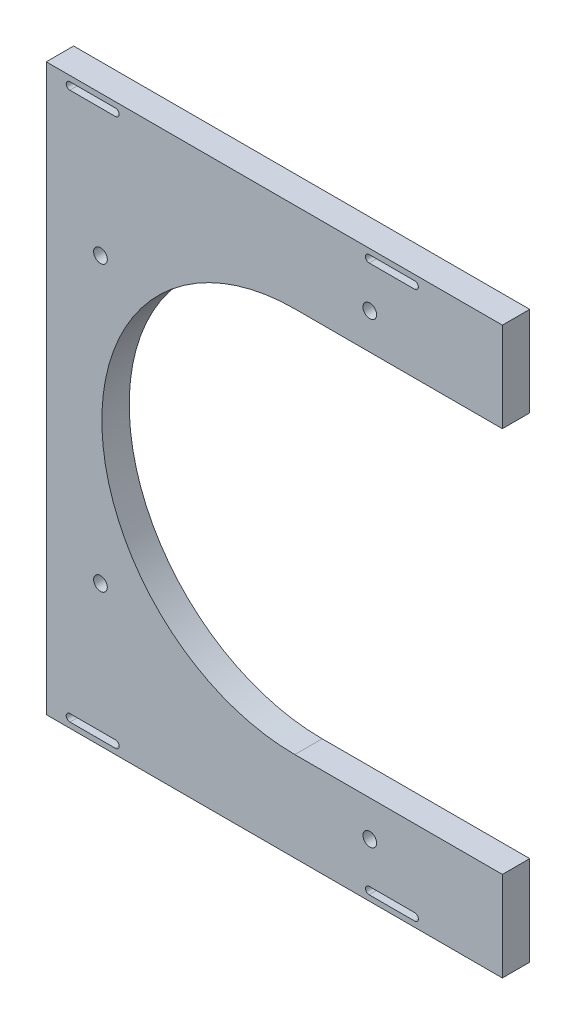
SolidWorks part; units mm, degrees
ref_plane "Front" through (0, 0, 0) normal (0, 0, 1) x (1, 0, 0)
ref_plane "Top" through (0, 0, 0) normal (0, 1, 0) x (1, 0, 0)
ref_plane "Right" through (0, 0, 0) normal (1, 0, 0) x (0, 0, -1)
sketch "Sketch1" plane through (0, 0, 0) normal (0, 0, 1) x (1, 0, 0)
  line L0 (101.5992, -196.8498) -> (608.1509, -196.8498) construction
  line L1 (292.7889, -196.8498) -> (610.3882, -196.8498)
  line L2 (608.1509, 196.8498) -> (101.5992, 196.8498) construction
  line L3 (610.3882, 196.8498) -> (292.7889, 196.8498)
  line L4 (292.7889, -196.8498) -> (292.7889, 196.8498)
  line L5 (610.3882, -196.8498) -> (610.3882, 196.8498)
  line L6 (611.9122, 224.79) -> (611.9122, -224.79) construction
  dimension "D1" = 1.524
extrude "Extrude1" add sketch "Sketch1" along normal blind 19.05
sketch "Sketch3" [suppressed] plane through (0, 0, 19.05) normal (0, 0, 1) x (1, 0, 0)
  line L2 (278.6021, 0) -> (643.1679, 0) construction
  circle A0 centre (518.0731, -159.3022) radius 21.9945
  circle A1 centre (330.5268, -98.8659) radius 21.9945
  circle A2 centre (308.2227, 67.9767) radius 2.1781
  circle A3 centre (352.8308, 129.755) radius 2.1781
  circle A5 centre (556.1731, -159.3022) radius 2.1781
  circle A6 centre (479.9731, -159.3022) radius 2.1781
  circle A7 centre (352.8308, -129.755) radius 2.1781
  circle A8 centre (308.2227, -67.9767) radius 2.1781
  circle A9 centre (479.9731, 159.3022) radius 2.1781
  circle A10 centre (556.1731, 159.3022) radius 2.1781
  circle A11 centre (330.5268, 98.8659) radius 21.9945
  circle A12 centre (518.0731, 159.3022) radius 21.9945
  dimension "D1" = 43.989
extrude "Cut-Extrude1" [suppressed] cut sketch "Sketch3" against normal through all
sketch "Sketch6" plane through (0, 0, 19.05) normal (0, 0, 1) x (1, 0, 0)
  line L0 (601.6307, 190.4998) -> (256.0125, 190.4998) construction
  line L1 (292.7889, 196.8498) -> (292.7889, -196.8498) construction
  line L2 (610.3882, 134.3733) -> (465.8622, 134.3733)
  line L3 (610.3882, -134.3733) -> (465.8622, -134.3733)
  line L4 (429.2895, 147.1863) -> (429.2895, 221.4061) construction
  line L5 (340.9796, 187.9471) -> (309.2296, 187.9471)
  line L6 (517.5994, 193.0525) -> (549.3494, 193.0525)
  line L7 (340.9796, 193.0525) -> (309.2296, 193.0525)
  line L8 (517.5994, 187.9471) -> (549.3494, 187.9471)
  line L9 (747.896, 0) -> (-828.8894, 0) construction
  line L10 (517.5994, -187.9471) -> (549.3494, -187.9471)
  line L11 (340.9796, -193.0525) -> (309.2296, -193.0525)
  line L12 (517.5994, -193.0525) -> (549.3494, -193.0525)
  line L13 (340.9796, -187.9471) -> (309.2296, -187.9471)
  line L14 (610.3882, 196.8498) -> (292.7889, 196.8498) construction
  line L15 (610.3882, 134.3733) -> (610.3882, -134.3733)
  arc A0 (309.2296, 193.0525) -> (309.2296, 187.9471) centre (309.2296, 190.4998) ccw
  arc A1 (340.9796, 187.9471) -> (340.9796, 193.0525) centre (340.9796, 190.4998) ccw
  arc A2 (517.5994, 187.9471) -> (517.5994, 193.0525) centre (517.5994, 190.4998) cw
  arc A3 (549.3494, 193.0525) -> (549.3494, 187.9471) centre (549.3494, 190.4998) cw
  arc A4 (549.3494, -193.0525) -> (549.3494, -187.9471) centre (549.3494, -190.4998) ccw
  arc A5 (517.5994, -187.9471) -> (517.5994, -193.0525) centre (517.5994, -190.4998) ccw
  arc A6 (340.9796, -187.9471) -> (340.9796, -193.0525) centre (340.9796, -190.4998) cw
  arc A7 (309.2296, -193.0525) -> (309.2296, -187.9471) centre (309.2296, -190.4998) cw
  arc A8 (465.8622, 134.3733) -> (465.8622, -134.3733) centre (465.8622, 0) ccw
  dimension "D2" = 31.75
  dimension "D3" = 6.35
  dimension "D4" = 2.5527
  dimension "D5" = 16.4408
  dimension "D1" = 5.1054
extrude "Cut-Extrude2" cut sketch "Sketch6" against normal through all
hole_wizard "3/8 (0.375000) Diameter Hole1" positions "Sketch9" profile "Sketch8" hole size "3/8" standard "Ansi Inch"
sketch "Sketch9" plane through (0, 0, 0) normal (0, 0, -1) x (-1, 0, 0)
  point P1 (-518.0731, 159.3022)
  point P2 (-330.5268, 98.8659)
  point P4 (-330.5268, -98.8659)
  point P6 (-518.0731, -159.3022)
sketch "Sketch8" plane through (518.0731, 159.3022, 0) normal (1, 0, 0) x (0, 1, 0)
  line L0 (0, 0) -> (0, 19.05)
  line L1 (0, 19.05) -> (4.7625, 19.05)
  line L2 (4.7625, 19.05) -> (4.7625, 0)
  line L5 (4.7625, 0) -> (0, 0)
  line L11 (0, -6.35) -> (0, 107.95) construction
  dimension "Thru Hole Dia." = 9.525
  dimension "Thru Hole Depth" = 19.05
sketch "Sketch10" plane through (0, 0, 0) normal (0, 0, -1) x (-1, 0, 0)
  circle A0 centre (-518.0731, 159.3022) radius 11.1125
  circle A1 centre (-330.5268, 98.8659) radius 11.1125
  circle A2 centre (-330.5268, -98.8659) radius 11.1125
  circle A3 centre (-518.0731, -159.3022) radius 11.1125
  dimension "D1" = 22.225
extrude "Cut-Extrude3" cut sketch "Sketch10" against normal blind 9.525
sketch "Sketch15" plane through (0, 0, 19.05) normal (0, 0, 1) x (1, 0, 0)
  line L0 (610.3882, 134.3733) -> (610.3882, 196.8498) construction
  line L1 (553.2382, 184.6616) -> (578.6382, 184.6616)
  line L2 (546.8882, 178.3116) -> (546.8882, 152.9116)
  line L3 (553.2382, 146.5616) -> (578.6382, 146.5616)
  line L4 (584.9882, 178.3116) -> (584.9882, 152.9116)
  line L8 (623.8159, 165.6116) -> (534.8139, 165.6116) construction
  line L9 (610.3882, 196.8498) -> (292.7889, 196.8498) construction
  line L10 (610.3882, 134.3733) -> (465.8622, 134.3733) construction
  line L11 (646.9222, 0) -> (401.7389, 0) construction
  line L12 (584.9882, -178.3116) -> (584.9882, -152.9116)
  line L13 (553.2382, -146.5616) -> (578.6382, -146.5616)
  line L14 (546.8882, -178.3116) -> (546.8882, -152.9116)
  line L15 (553.2382, -184.6616) -> (578.6382, -184.6616)
  arc A0 (584.9882, 178.3116) -> (578.6382, 184.6616) centre (578.6382, 178.3116) ccw
  arc A1 (584.9882, 152.9116) -> (578.6382, 146.5616) centre (578.6382, 152.9116) cw
  arc A2 (546.8882, 152.9116) -> (553.2382, 146.5616) centre (553.2382, 152.9116) ccw
  arc A3 (553.2382, 184.6616) -> (546.8882, 178.3116) centre (553.2382, 178.3116) ccw
  arc A4 (553.2382, -184.6616) -> (546.8882, -178.3116) centre (553.2382, -178.3116) cw
  arc A5 (546.8882, -152.9116) -> (553.2382, -146.5616) centre (553.2382, -152.9116) cw
  arc A6 (584.9882, -152.9116) -> (578.6382, -146.5616) centre (578.6382, -152.9116) ccw
  arc A7 (584.9882, -178.3116) -> (578.6382, -184.6616) centre (578.6382, -178.3116) cw
  point P6 (584.9882, 184.6616)
  point P9 (584.9882, 146.5616)
  point P14 (546.8882, 184.6616)
  dimension "D3" = 6.35
  dimension "D1" = 38.1
  dimension "D2" = 38.1
  dimension "D4" = 25.4
extrude "Cut-Extrude5" [suppressed] cut sketch "Sketch15" against normal through all
sketch "Sketch14" plane through (610.3882, 0, 0) normal (1, 0, 0) x (0, 0, -1)
  line L1 (178.6076, 0) -> (-501.505, 0) construction
  line L5 (-9.525, 148.1897) -> (-9.525, 170.4147) construction
  line L6 (-38.5656, 165.6116) -> (24.0573, 165.6116) construction
  line L7 (-9.525, 205.4456) -> (-9.525, 128.2834) construction
  line L8 (-19.05, 134.3733) -> (-19.05, 196.8498) construction
  line L9 (0, 134.3733) -> (0, 196.8498) construction
  line L10 (-19.05, 196.8498) -> (0, 196.8498) construction
  line L11 (0, 134.3733) -> (-19.05, 134.3733) construction
  circle A0 centre (-9.525, 165.6116) radius 3.937
  circle A1 centre (-9.525, -165.6116) radius 3.937
  dimension "D1" = 7.874
extrude "Cut-Extrude4" [suppressed] cut sketch "Sketch14" against normal up to next
